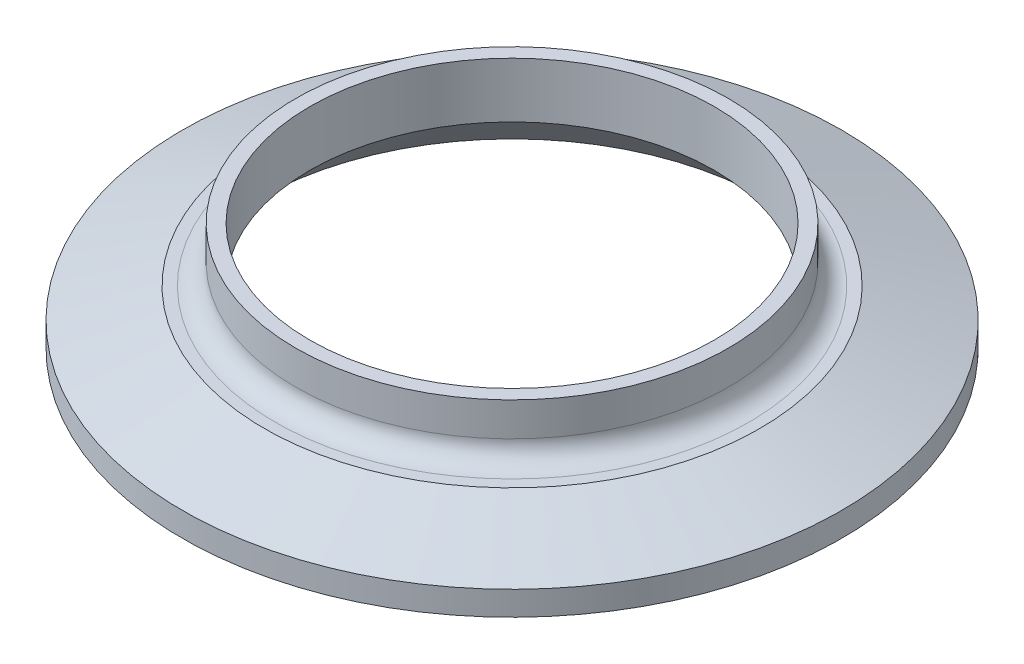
SolidWorks part; units mm, degrees
ref_plane "Front Plane" through (0, 0, 0) normal (0, 0, 1) x (1, 0, 0)
ref_plane "Top Plane" through (0, 0, 0) normal (0, 1, 0) x (1, 0, 0)
ref_plane "Right Plane" through (0, 0, 0) normal (1, 0, 0) x (0, 0, -1)
sketch "Sketch1" plane through (0, 0, 0) normal (0, 0, 1) x (1, 0, 0)
  line L0 (0, 0) -> (0, 8.8532) construction
  line L1 (-25.4, 12.7) -> (-25.4, 8.7376)
  line L2 (-27.7876, 6.35) -> (-29.0664, 6.35)
  line L3 (-29.0664, 6.35) -> (-38.6969, 2.8448)
  line L4 (-38.6969, 2.8448) -> (-38.6969, 0)
  line L5 (-38.6969, 0) -> (-36.9029, 0.0025)
  line L6 (-30.099, 0) -> (-33.6725, -0.1437)
  line L10 (-30.099, 0) -> (-23.749, 6.2184)
  line L11 (-23.749, 6.2184) -> (-23.749, 12.7)
  line L12 (-23.749, 12.7) -> (-25.4, 12.7)
  line L15 (-36.0732, 0.7292) -> (-36.1781, 0.4823)
  line L17 (-34.5642, 0.7292) -> (-34.3973, 0.3361)
  arc A0 (-27.7876, 6.35) -> (-25.4, 8.7376) centre (-27.7876, 8.7376) ccw
  arc A1 (-36.1781, 0.4823) -> (-36.9029, 0.0025) centre (-36.9029, 0.7899) cw
  arc A2 (-33.6725, -0.1437) -> (-34.3973, 0.3361) centre (-33.6725, 0.6437) cw
  arc A3 (-34.5642, 0.7292) -> (-36.0732, 0.7292) centre (-35.3187, 0.4089) ccw
  dimension "D3" = 2.3876
  dimension "D7" = 0.7874
  dimension "D8" = 35.3187
  dimension "D9" = 0.7874
  dimension "D2" = 23.749
  dimension "D4" = 12.7
  dimension "D5" = 6.35
  dimension "D6" = 38.6969
  dimension "D10" = 20
  dimension "D11" = 30.099
  dimension "D12" = 25.4
  dimension "D13" = 2.8448
  dimension "D14" = 45.6
revolve "Revolve1" add sketch "Sketch1" angle 360 about L0
